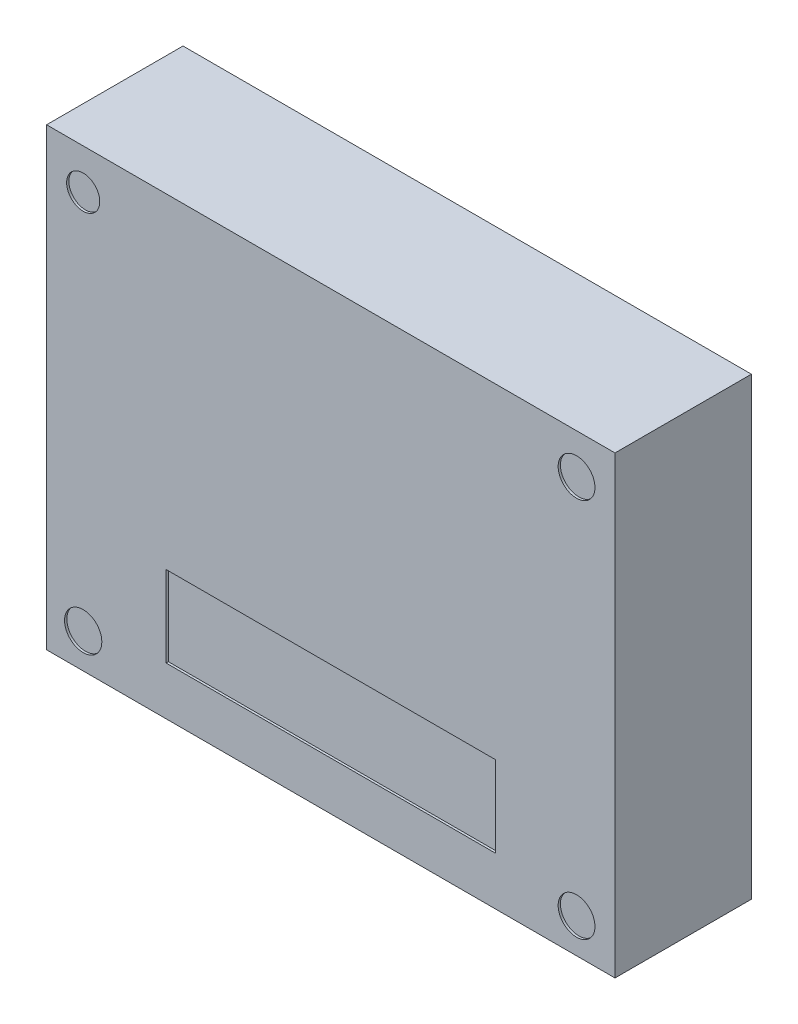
SolidWorks part; units mm, degrees
ref_plane "Plan de face" through (0, 0, 0) normal (0, 0, 1) x (1, 0, 0)
ref_plane "Plan de dessus" through (0, 0, 0) normal (0, 1, 0) x (1, 0, 0)
ref_plane "Plan de droite" through (0, 0, 0) normal (1, 0, 0) x (0, 0, -1)
sketch "Esquisse1" plane through (0, 0, 0) normal (0, 1, 0) x (1, 0, 0)
  line L1 (125, -30) -> (-125, -30)
  line L2 (125, -30) -> (125, 30)
  line L3 (125, 30) -> (-125, 30)
  line L4 (-125, -30) -> (-125, 30)
  line L5 (125, -30) -> (-125, 30) construction
  line L6 (125, 30) -> (-125, -30) construction
  point P0 (0, 0)
  dimension "D1" = 250
  dimension "D2" = 60
extrude "Boss.-Extru.1" add sketch "Esquisse1" along normal blind 200
sketch "Esquisse2" plane through (0, 0, 30) normal (0, 0, 1) x (1, 0, 0)
  line L1 (-72.4682, 56.8834) -> (72.4682, 56.8834)
  line L2 (-72.4682, 56.8834) -> (-72.4682, 21.2566)
  line L3 (-72.4682, 21.2566) -> (72.4682, 21.2566)
  line L4 (72.4682, 56.8834) -> (72.4682, 21.2566)
  line L5 (-72.4682, 56.8834) -> (72.4682, 21.2566) construction
  line L6 (-72.4682, 21.2566) -> (72.4682, 56.8834) construction
  point P0 (0, 39.07)
extrude "Enlèv. mat.-Extru.1" cut sketch "Esquisse2" against normal blind 1
sketch "Esquisse3" plane through (0, 0, 30) normal (0, 0, 1) x (1, 0, 0)
  circle A0 centre (-108.9047, 182.387) radius 7.2873
  circle A1 centre (-108.9047, 15.1839) radius 8.1976
  circle A2 centre (108.095, 15.1839) radius 8.097
  circle A3 centre (108.095, 182.387) radius 8.097
extrude "Enlèv. mat.-Extru.2" cut sketch "Esquisse3" against normal blind 1
